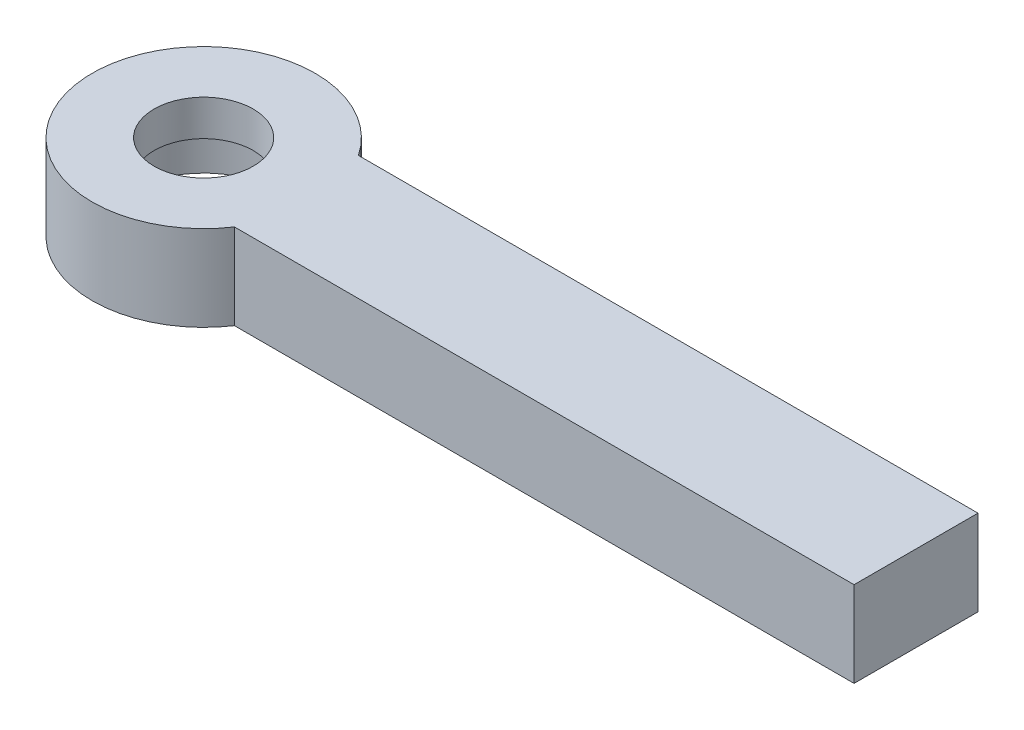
SolidWorks part; units mm, degrees
ref_plane "Front Plane" through (0, 0, 0) normal (0, 0, 1) x (1, 0, 0)
ref_plane "Top Plane" through (0, 0, 0) normal (0, 1, 0) x (1, 0, 0)
ref_plane "Right Plane" through (0, 0, 0) normal (1, 0, 0) x (0, 0, -1)
sketch "Sketch1" plane through (0, 0, 0) normal (0, 1, 0) x (1, 0, 0)
  line L0 (9.5038, -6.35) -> (73.0038, -6.35)
  line L1 (73.0038, -6.35) -> (73.0038, 6.35)
  line L2 (73.0038, 6.35) -> (9.5038, 6.35)
  circle A0 centre (0, 0) radius 5.08
  arc A2 (9.5038, -6.35) -> (9.5038, 6.35) centre (0, 0) cw
  dimension "D1" = 12.7
  dimension "D2" = 63.5
extrude "Boss-Extrude1" add sketch "Sketch1" along normal blind 8.763
sketch "Sketch2" plane through (0, 0, 0) normal (0, -1, 0) x (1, 0, 0)
  circle A0 centre (0, 0) radius 7.9375
extrude "Cut-Extrude1" cut sketch "Sketch2" against normal blind 5.08
